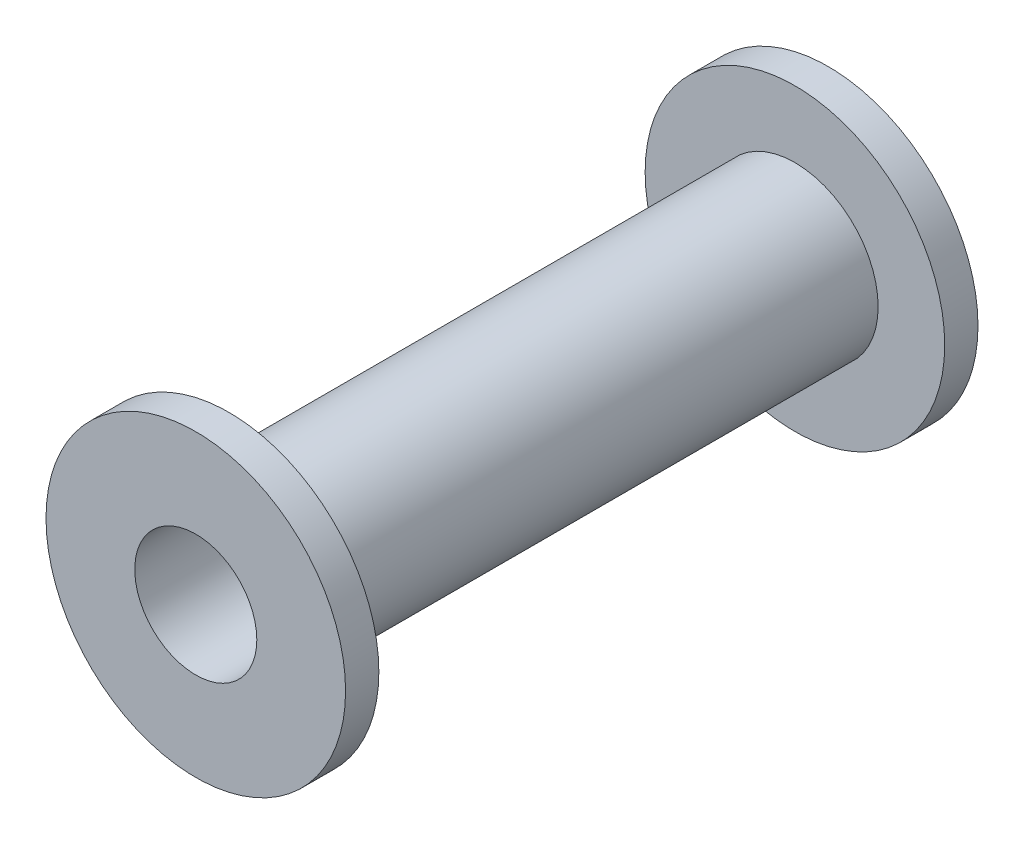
SolidWorks part; units mm, degrees
ref_plane "Plano frontal" through (0, 0, 0) normal (0, 0, 1) x (1, 0, 0)
ref_plane "Plano superior" through (0, 0, 0) normal (0, 1, 0) x (1, 0, 0)
ref_plane "Plano direito" through (0, 0, 0) normal (1, 0, 0) x (0, 0, -1)
sketch "Esboço1" plane through (0, 0, 0) normal (0, 0, 1) x (1, 0, 0)
  circle A0 centre (0, 0) radius 5.5
  circle A1 centre (0, 0) radius 13.5
  dimension "D1" = 11
  dimension "D2" = 27
extrude "Ressalto-extrusão1" add sketch "Esboço1" along normal blind 3
sketch "Esboço2" plane through (0, 0, 3) normal (0, 0, 1) x (1, 0, 0)
  circle A0 centre (0, 0) radius 7.5
  circle A1 centre (0, 0) radius 5.5
  circle A2 centre (0, 0) radius 5.5 construction
  dimension "D1" = 15
extrude "Ressalto-extrusão2" add sketch "Esboço2" along normal blind 51
sketch "Esboço3" plane through (0, 0, 54) normal (0, 0, 1) x (1, 0, 0)
  circle A0 centre (0, 0) radius 13.5
  circle A1 centre (0, 0) radius 5.5
  dimension "D1" = 11
  dimension "D2" = 27
extrude "Ressalto-extrusão3" add sketch "Esboço3" along normal blind 3
sketch "Esboço6" plane through (0, 0, 0) normal (0, 0, -1) x (-1, 0, 0)
  line L0 (0, 0) -> (0, 9) construction
  dimension "D1" = 9
